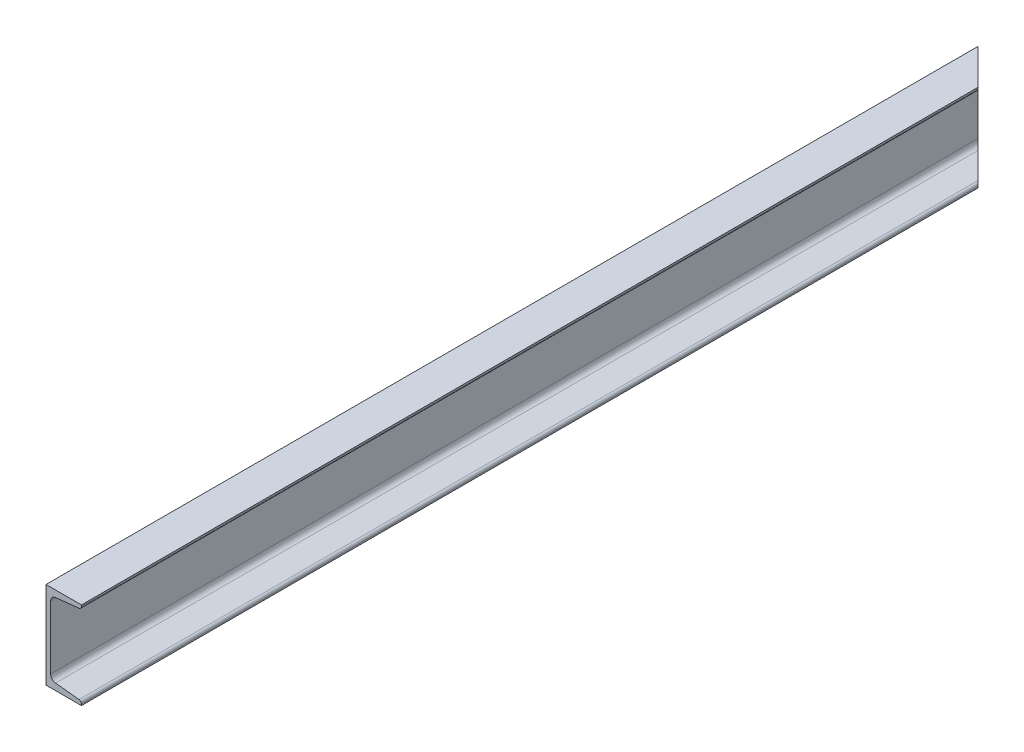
SolidWorks part; units mm, degrees
ref_plane "前视基准面" through (0, 0, 0) normal (0, 0, 1) x (1, 0, 0)
ref_plane "上视基准面" through (0, 0, 0) normal (0, 1, 0) x (1, 0, 0)
ref_plane "右视基准面" through (0, 0, 0) normal (1, 0, 0) x (0, 0, -1)
sketch "草图1" plane through (0, 0, 0) normal (0, 0, 1) x (1, 0, 0)
  line L0 (0, 80) -> (0, -80)
  line L1 (0, -80) -> (65, -80)
  line L2 (65, -80) -> (65, -77.4971)
  line L3 (60.528, -72.5251) -> (17.444, -67.9498)
  line L4 (8.5, -58.0057) -> (8.5, 58.0057)
  line L5 (17.444, 67.9498) -> (60.528, 72.5251)
  line L6 (65, 77.4971) -> (65, 80)
  line L7 (65, 80) -> (0, 80)
  line L8 (36.75, 80) -> (36.75, 70) construction
  line L9 (36.75, -70) -> (36.75, -80) construction
  arc A0 (8.5, 58.0057) -> (17.444, 67.9498) centre (18.5, 58.0057) cw
  arc A1 (17.444, -67.9498) -> (8.5, -58.0057) centre (18.5, -58.0057) cw
  arc A2 (60.528, 72.5251) -> (65, 77.4971) centre (60, 77.4971) ccw
  arc A3 (65, -77.4971) -> (60.528, -72.5251) centre (60, -77.4971) ccw
  point P19 (65, 73)
  point P22 (65, -73)
  dimension "D11" = 10
  dimension "D12" = 5
  dimension "D1" = 160
  dimension "D2" = 80
  dimension "D3" = 8.5
  dimension "D4" = 65
  dimension "D5" = 65
  dimension "D6" = 7
  dimension "D7" = 7
  dimension "D8" = 28.25
  dimension "D9" = 10
  dimension "D10" = 10
extrude "拉伸1" add sketch "草图1" along normal mid plane 1710
sketch "草图2" plane through (0, 80, 0) normal (0, 1, 0) x (-1, 0, 0)
  line L0 (-65, -855) -> (0, -855)
  line L1 (-65, -855) -> (-65, -790)
  line L3 (-65, 855) -> (-65, -855) construction
  line L4 (-65, -790) -> (0, -855)
  dimension "D1" = 45
extrude "切除-拉伸1" cut sketch "草图2" against normal through all
